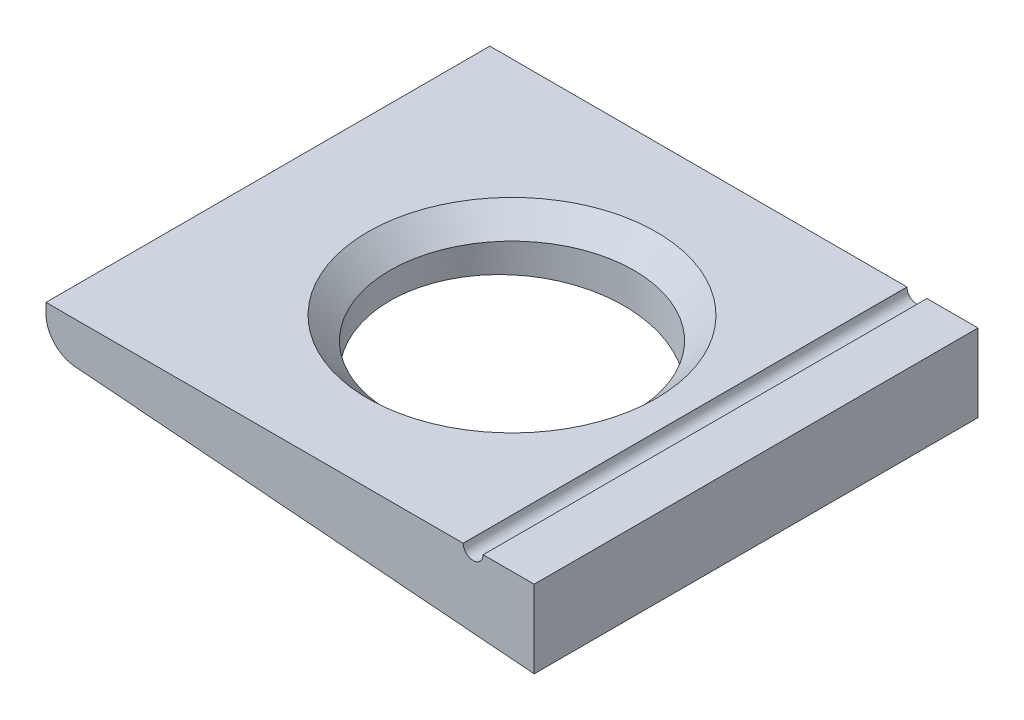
SolidWorks part; units mm, degrees
ref_plane "Plane1" through (0, 0, 0) normal (0, 0, 1) x (1, 0, 0)
ref_plane "Plane2" through (0, 0, 0) normal (0, 1, 0) x (1, 0, 0)
ref_plane "Plane3" through (0, 0, 0) normal (1, 0, 0) x (0, 0, -1)
sketch "Sketch1" plane through (0, 0, 0) normal (0, 0, 1) x (1, 0, 0)
  line L0 (22, 0) -> (-22, 0)
  line L1 (22, 0) -> (22, -7)
  line L2 (-22, 0) -> (-22, -0.9139)
  line L3 (22, -7) -> (-19.422, -3.7051)
  line L4 (0, 0) -> (0, -5.25) construction
  arc A0 (-19.422, -3.7051) -> (-22, -0.9139) centre (-19.2, -0.9139) cw
  dimension "R" = 2.8
  dimension "B" = 44
  dimension "D2" = 22
  dimension "H" = 7
  dimension "E" = 5.25
extrude "Base-Extrude" add sketch "Sketch1" along normal mid plane 40
sketch "Sketch2" plane through (0, 0, 0) normal (0, 1, 0) x (-1, 0, 0)
  circle A0 centre (0, 0) radius 11
  dimension "D" = 22
extrude "Cut-Extrude1" cut sketch "Sketch2" against normal through all
sketch "Sketch3" plane through (0, 0, 20) normal (0, 0, 1) x (1, 0, 0)
  line L0 (22, 0) -> (-22, 0) construction
  circle A0 centre (16.5, 0) radius 0.9
  dimension "T" = 0.9
  dimension "D2" = 16.5
extrude "ID-Grooves" cut sketch "Sketch3" against normal through all
chamfer "Chamfer1" distance 2 angle 45 1 edges at (-11, 0, 0)
equation "\"D2@Sketch1\" = \"B@Sketch1\" / 2"
equation "\"D2@Sketch3\" =  ( \"D@Sketch2\" / 2 )  +  ( \"B@Sketch1\" -  \"D@Sketch2\" )  / 4"
